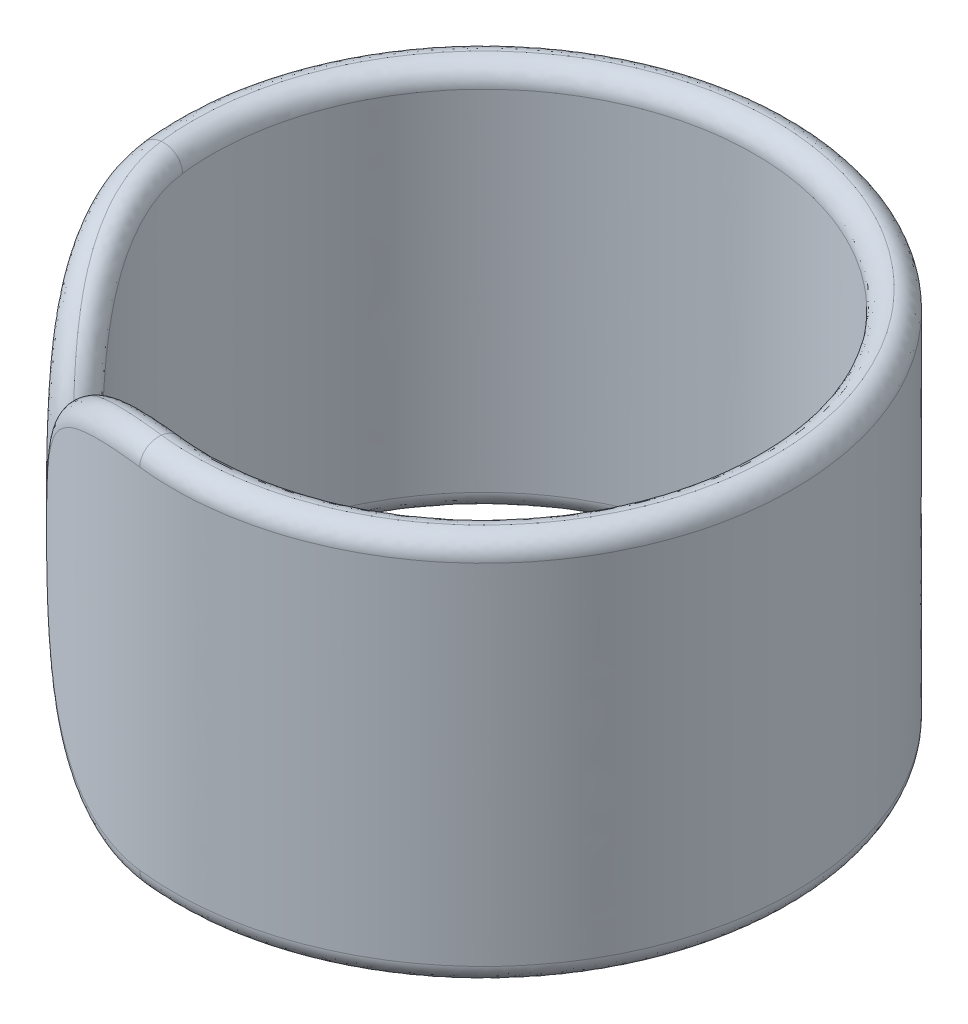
SolidWorks part; units mm, degrees
ref_plane "Plan de face" through (0, 0, 0) normal (0, 0, 1) x (1, 0, 0)
ref_plane "Plan de dessus" through (0, 0, 0) normal (0, 1, 0) x (1, 0, 0)
ref_plane "Plan de droite" through (0, 0, 0) normal (1, 0, 0) x (0, 0, -1)
sketch "Esquisse1" plane through (0, 0, 0) normal (0, 0, 1) x (1, 0, 0)
  line L0 (-185, 50) -> (185, 50)
  line L1 (-185, -50) -> (185, -50)
  line L2 (0, 69.7347) -> (0, -62.5489) construction
  line L3 (-111.484, 0) -> (111.484, 0) construction
  arc A0 (-185, 50) -> (-185, -50) centre (-185, 0) ccw
  arc A1 (185, -50) -> (185, 50) centre (185, 0) ccw
  dimension "D1" = 100
  dimension "D2" = 370
extrude "Extrusion1" add sketch "Esquisse1" along normal blind 10
fillet "Congé1" radius 5 8 edges at (0, -50, 0) (235, 0, 0) (0, 50, 0) (-235, 0, 0) (0, 50, 10) (235, 0, 10) (0, -50, 10) (-235, 0, 10)
sketch "Esquisse2" plane through (0, 0, 0) normal (0, 1, 0) x (1, 0, 0)
  circle A0 centre (0, 74.8408) radius 74.8408
  dimension "D1" = 149.6815
sketch "Esquisse3" plane through (0, 0, 0) normal (0, 1, 0) x (1, 0, 0)
  line L0 (-235, -5) -> (235, -5)
  line L1 (-235, -5) -> (-185, -5) construction
  arc A0 (-230, 0) -> (-235, -5) centre (-230, -5) ccw construction
  arc A1 (-235, -5) -> (-230, -10) centre (-230, -5) ccw construction
other "Déformer3" parameters "D1"=50, "D2"=50
